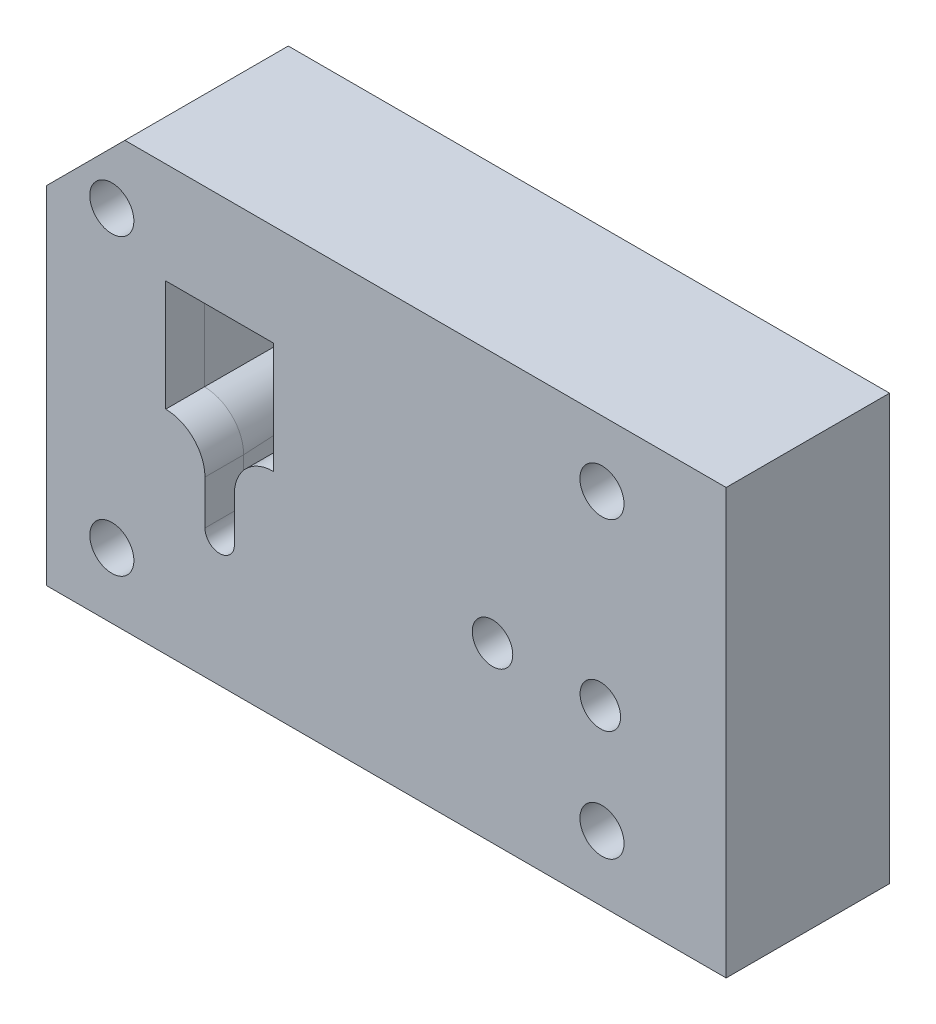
SolidWorks part; units mm, degrees
ref_plane "Face" through (0, 0, 0) normal (0, 0, 1) x (1, 0, 0)
ref_plane "Dessus" through (0, 0, 0) normal (0, 1, 0) x (1, 0, 0)
ref_plane "Droite" through (0, 0, 0) normal (1, 0, 0) x (0, 0, -1)
sketch "Esquisse1" plane through (0, 0, 0) normal (0, 0, 1) x (1, 0, 0)
  line L0 (205, 187) -> (113, 187) construction
  line L1 (205, 187) -> (113, 187)
  line L2 (205, 187) -> (205, 123) construction
  line L3 (205, 187) -> (205, 122)
  line L4 (101, 175) -> (101, 157.5) construction
  line L5 (101, 175) -> (101, 122)
  line L6 (113, 187) -> (101, 175)
  line L7 (101, 122) -> (205, 122)
  line L8 (129.75, 148.5) -> (129.75, 141.75) construction
  line L9 (125.25, 141.75) -> (125.25, 148.5) construction
  line L10 (129.75, 148.5) -> (129.75, 141.75)
  line L11 (125.25, 141.75) -> (125.25, 148.5)
  line L12 (135.75, 154.5) -> (135.75, 171.5)
  line L13 (135.75, 171.5) -> (119.25, 171.5)
  line L14 (119.25, 171.5) -> (119.25, 154.5)
  circle A0 centre (185.75, 148.5) radius 3.1
  circle A1 centre (169.25, 148.5) radius 3.1
  arc A2 (125.25, 148.5) -> (113.3076, 149.3296) centre (119.25, 148.5) ccw construction
  arc A3 (141.6924, 149.3296) -> (129.75, 148.5) centre (135.75, 148.5) ccw construction
  arc A4 (125.25, 141.75) -> (129.75, 141.75) centre (127.5, 141.75) ccw construction
  arc A5 (135.75, 154.5) -> (129.75, 148.5) centre (135.75, 148.5) ccw
  arc A6 (125.25, 141.75) -> (129.75, 141.75) centre (127.5, 141.75) ccw
  arc A7 (125.25, 148.5) -> (119.25, 154.5) centre (119.25, 148.5) ccw
  dimension "D2" = 6.2
  dimension "D3" = 6.2
  dimension "D4" = 29.75
  dimension "D1" = 65
  dimension "D5" = 16.5
extrude "Base-Extrusion" add sketch "Esquisse1" along normal blind 25
sketch "Esquisse3" plane through (0, 0, 0) normal (0, 0, -1) x (-1, 0, 0)
  line L15 (-118.25, 172.5) -> (-136.75, 172.5)
  line L16 (-118.25, 153.399) -> (-118.25, 172.5)
  line L17 (-124.25, 141.75) -> (-124.25, 148.5)
  line L18 (-130.75, 148.5) -> (-130.75, 141.75)
  line L19 (-136.75, 172.5) -> (-136.75, 153.399)
  line L20 (-118.25, 172.5) -> (-136.75, 172.5)
  line L21 (-118.25, 153.399) -> (-118.25, 172.5)
  line L22 (-124.25, 141.75) -> (-124.25, 148.5)
  line L23 (-130.75, 148.5) -> (-130.75, 141.75)
  line L24 (-136.75, 172.5) -> (-136.75, 153.399)
  arc A8 (-118.25, 153.399) -> (-124.25, 148.5) centre (-119.25, 148.5) ccw
  arc A9 (-130.75, 141.75) -> (-124.25, 141.75) centre (-127.5, 141.75) ccw
  arc A10 (-130.75, 148.5) -> (-136.75, 153.399) centre (-135.75, 148.5) ccw
  arc A11 (-118.25, 153.399) -> (-124.25, 148.5) centre (-119.25, 148.5) ccw
  arc A12 (-130.75, 141.75) -> (-124.25, 141.75) centre (-127.5, 141.75) ccw
  arc A13 (-130.75, 148.5) -> (-136.75, 153.399) centre (-135.75, 148.5) ccw
  dimension "D1" = 1
extrude "Enlèv. mat.-Extru.1" cut sketch "Esquisse3" against normal through all draft 3
sketch "Esquisse4" plane through (0, 0, 0) normal (0, 0, -1) x (-1, 0, 0)
  line L0 (-101, 175) -> (-101, 122) construction
  line L1 (-205, 187) -> (-113, 187) construction
  circle A0 centre (-111, 177) radius 3.375
  dimension "D1" = 6.75
  dimension "D2" = 10
  dimension "D3" = 10
extrude "Enlèv. mat.-Extru.2" cut sketch "Esquisse4" against normal through all
pattern_linear "Répétition linéaire1" count 2 spacing 75 along (1, 0, 0) count 2 spacing 45 along (0, -1, 0) of "Enlèv. mat.-Extru.2"
